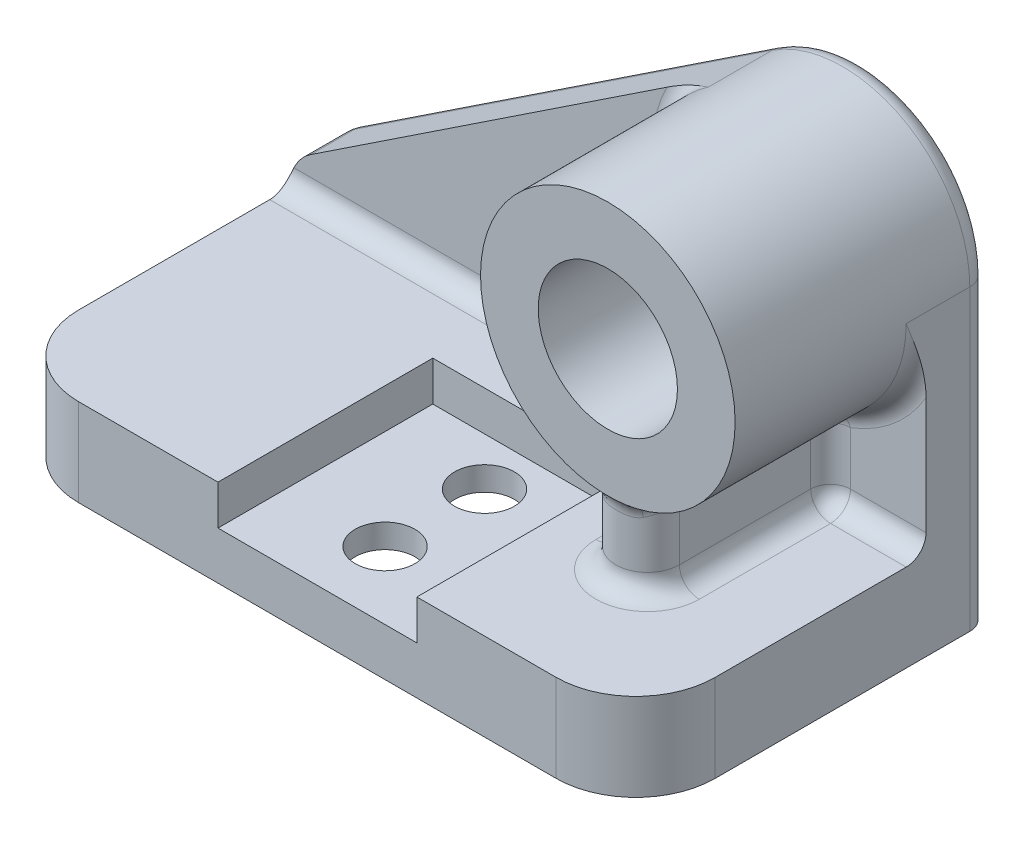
SolidWorks part; units mm, degrees
ref_plane "Front" through (0, 0, 0) normal (0, 0, 1) x (1, 0, 0)
ref_plane "Top" through (0, 0, 0) normal (0, 1, 0) x (1, 0, 0)
ref_plane "Right" through (0, 0, 0) normal (1, 0, 0) x (0, 0, -1)
sketch "Sketch1" plane through (0, 0, 0) normal (0, 1, 0) x (1, 0, 0)
  line L0 (0, 0) -> (160, 0)
  line L1 (0, 0) -> (0, 89)
  line L2 (160, 89) -> (0, 89)
  line L3 (160, 89) -> (160, 0)
  dimension "D3" = 89
  dimension "D4" = 160
extrude "Base_Plate" add sketch "Sketch1" along normal blind 22
fillet "Base_Fillet" radius 20 2 edges at (0, 11, 0) (160, 11, 0)
sketch "Sketch5" plane through (0, 22, 0) normal (0, 1, 0) x (-1, 0, 0)
  line L0 (-20, 0) -> (-140, 0) construction
  line L1 (-55, 0) -> (-105, 0)
  line L2 (-55, 0) -> (-55, -54)
  line L3 (-55, -54) -> (-105, -54)
  line L4 (-105, 0) -> (-105, -54)
  line L5 (-160, -89) -> (0, -89) construction
  line L6 (-80, 0) -> (-80, -89) construction
  dimension "D1" = 35
  dimension "D2" = 50
extrude "Cut-Extrude1" cut sketch "Sketch5" against normal blind 10
shell "Wall_Thickness" thickness 6
sketch "Sketch6" plane through (0, 12, 0) normal (0, 1, 0) x (-1, 0, 0)
  line L0 (-80, 0) -> (-80, -54) construction
  line L1 (-55, 0) -> (-105, 0) construction
  line L2 (-105, -54) -> (-55, -54) construction
  circle A0 centre (-80, -17) radius 7.5
  circle A1 centre (-80, -42) radius 7.5
  dimension "D1" = 15
  dimension "D2" = 12
  dimension "D3" = 25
extrude "Cut-Extrude2" cut sketch "Sketch6" against normal through all
sketch "Sketch2" plane through (0, 0, -89) normal (0, 0, -1) x (-1, 0, 0)
  line L1 (-20, 0) -> (-140, 0) construction
  line L2 (-160, 22) -> (0, 22) construction
  line L3 (-160, 22) -> (0, 22)
  line L4 (-160, 22) -> (-160, 0) construction
  line L5 (-160, 22) -> (-160, 75)
  line L6 (-5.3632, 31.9976) -> (-110.3018, 101.6603)
  arc A0 (-110.3018, 101.6603) -> (-160, 75) centre (-128, 75) ccw
  arc A1 (0, 22) -> (-5.3632, 31.9976) centre (-12, 22) ccw
  dimension "D1" = 64
  dimension "D4" = 12
  dimension "D2" = 75
extrude "Vertical_Plate" add sketch "Sketch2" against normal blind 16
ref_plane "Circular_Plane" through (0, 0, -100) normal (0, 0, -1) x (-1, 0, 0)
sketch "Sketch3" plane through (0, 0, -89) normal (0, 0, -1) x (-1, 0, 0)
  circle A0 centre (-128, 75) radius 32
  arc A1 (-110.3018, 101.6603) -> (-160, 75) centre (-128, 75) ccw construction
extrude "Circular_Boss" add sketch "Sketch3" against normal blind 64
sketch "Sketch4" plane through (0, 22, 0) normal (0, 1, 0) x (-1, 0, 0)
  line L0 (-96, -25) -> (-160, -25) construction
  line L1 (-96, -73) -> (-160, -73) construction
  line L2 (-120, -73) -> (-120, -35)
  line L3 (-128, -73) -> (-128, -89) construction
  line L5 (-136, -73) -> (-136, -35)
  line L7 (-136, -73) -> (-120, -73)
  arc A0 (-136, -35) -> (-120, -35) centre (-128, -35) cw
  dimension "D1" = 2
  dimension "D2" = 8
extrude "Rib_Under" add sketch "Sketch4" along normal up to next
fillet "Rib_Fillet" radius 5 7 edges at (120, 44.0161, -54) (120, 22, -54) (128, 22, -27) (136, 22, -54) (136, 44.0161, -54) (128.8079, 43.0102, -27.0409)
fillet "Circ_Fillet" radius 5 18 edges at (136, 33.6795, -73) (136.89, 43.2065, -73) (137.4645, 23.4645, -73) (96.206, 71.3753, -73) (120, 33.6795, -73) (119.11, 43.2065, -73) (118.5355, 23.4645, -73) (160, 37.5, -89) (0, 11, -89) (1.4255, 27.6726, -89) (57.8325, 66.829, -89) (143.1271, 103.1988, -89) (154.3038, 56.7762, -73)
sketch "Sketch7" plane through (0, 0, -25) normal (0, 0, 1) x (1, 0, 0)
  circle A0 centre (128, 75) radius 17.5
  dimension "D1" = 35
extrude "Cut-Extrude3" cut sketch "Sketch7" against normal through all
